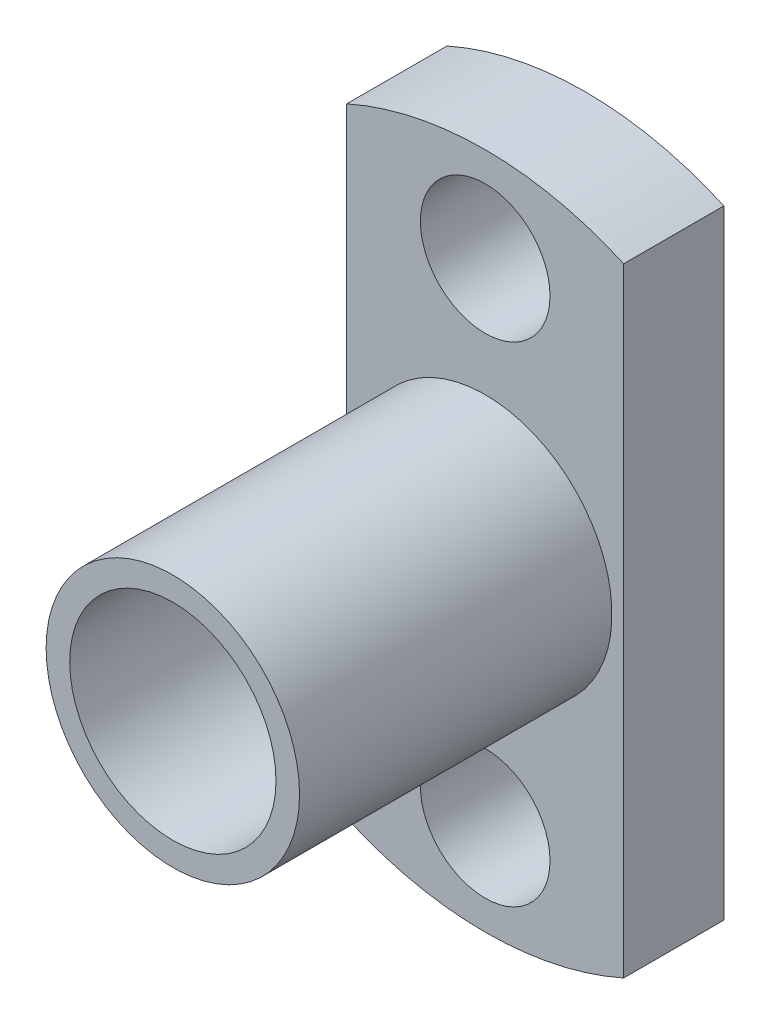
SolidWorks part; units mm, degrees
ref_plane "前视" through (0, 0, 0) normal (0, 0, 1) x (1, 0, 0)
ref_plane "上视" through (0, 0, 0) normal (0, 1, 0) x (1, 0, 0)
ref_plane "右视" through (0, 0, 0) normal (1, 0, 0) x (0, 0, -1)
sketch "草图1" plane through (0, 0, 0) normal (0, 0, 1) x (1, 0, 0)
  line L0 (0, 0) -> (2.35, 0) construction
  line L1 (2.35, 0) -> (2.35, 5.2479)
  line L2 (2.35, 0) -> (2.35, -5.2479)
  line L3 (0, 0) -> (-2.35, 0) construction
  line L4 (-2.35, 5.2479) -> (-2.35, -5.2479)
  arc A1 (-2.35, 5.2479) -> (2.35, 5.2479) centre (0, 0) cw
  arc A2 (-2.35, -5.2479) -> (2.35, -5.2479) centre (0, 0) ccw
  dimension "D2" = 2.35
  dimension "D3" = 2.35
extrude "凸台-拉伸1" add sketch "草图1" along normal blind 1.7
sketch "草图2" plane through (0, 0, 1.7) normal (0, 0, 1) x (1, 0, 0)
  circle A0 centre (0, 0) radius 2.15
  dimension "D1" = 4.3
extrude "凸台-拉伸2" add sketch "草图2" along normal blind 5.3
sketch "草图3" plane through (0, 0, 7) normal (0, 0, 1) x (1, 0, 0)
  circle A0 centre (0, 0) radius 1.75
  dimension "D1" = 3.5
extrude "切除-拉伸1" cut sketch "草图3" against normal blind 3.3
sketch "草图4" plane through (0, 0, 3.7) normal (0, 0, 1) x (1, 0, 0)
  circle A0 centre (0, 0) radius 0.19
  dimension "D1" = 0.38
extrude "凸台-拉伸3" add sketch "草图4" along normal blind 1
sketch "草图5" plane through (0, 0, 1.7) normal (0, 0, 1) x (1, 0, 0)
  circle A0 centre (0, 4.15) radius 1.1
  circle A1 centre (0, -4.15) radius 1.1
  dimension "D1" = 2.2
  dimension "D3" = 2.2
  dimension "D2" = 4.15
  dimension "D4" = 4.15
extrude "切除-拉伸2" cut sketch "草图5" against normal through all
sketch "草图6" plane through (0, 0, 0) normal (0, 0, -1) x (-1, 0, 0)
  circle A0 centre (0, 0) radius 0.19
  dimension "D1" = 0.38
extrude "切除-拉伸3" cut sketch "草图6" against normal blind 1
